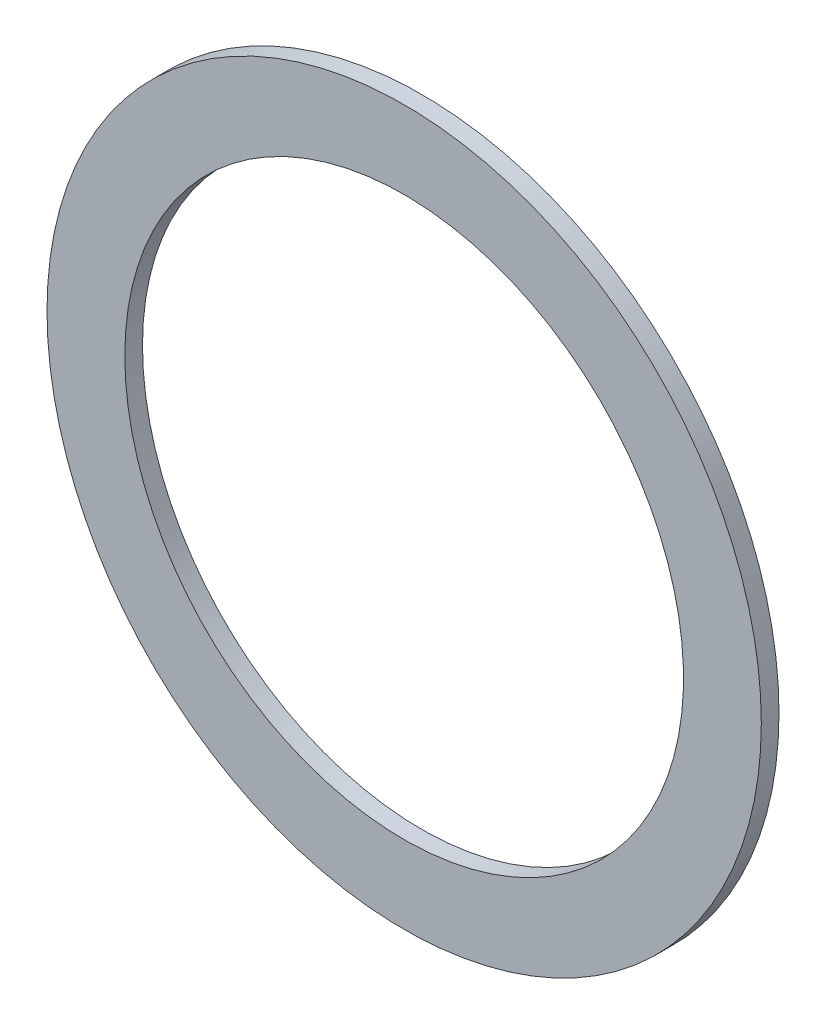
SolidWorks part; units mm, degrees
ref_plane "Plan de face" through (0, 0, 0) normal (0, 0, 1) x (1, 0, 0)
ref_plane "Plan de dessus" through (0, 0, 0) normal (0, 1, 0) x (1, 0, 0)
ref_plane "Plan de droite" through (0, 0, 0) normal (1, 0, 0) x (0, 0, -1)
sketch "Esquisse2" plane through (0, 0, 0) normal (0, 1, 0) x (-1, 0, 0)
  line L0 (-20.2, 0) -> (20.2, 0) construction
  line L1 (-20.2, 0) -> (-15.8, 0)
  line L2 (-20.2, 0) -> (-20.2, 1)
  line L3 (-20.2, 1) -> (-15.8, 1)
  line L4 (-15.8, 0) -> (-15.8, 1)
  line L5 (-20.2, 3.5403) -> (-20.2, 0) construction
  line L6 (-15.8, 3.5403) -> (-15.8, 0) construction
  line L7 (0, 0) -> (0, 13.0735) construction
  dimension "D1" = 1
revolve "Révolution1" add sketch "Esquisse2" angle 360 about L7
